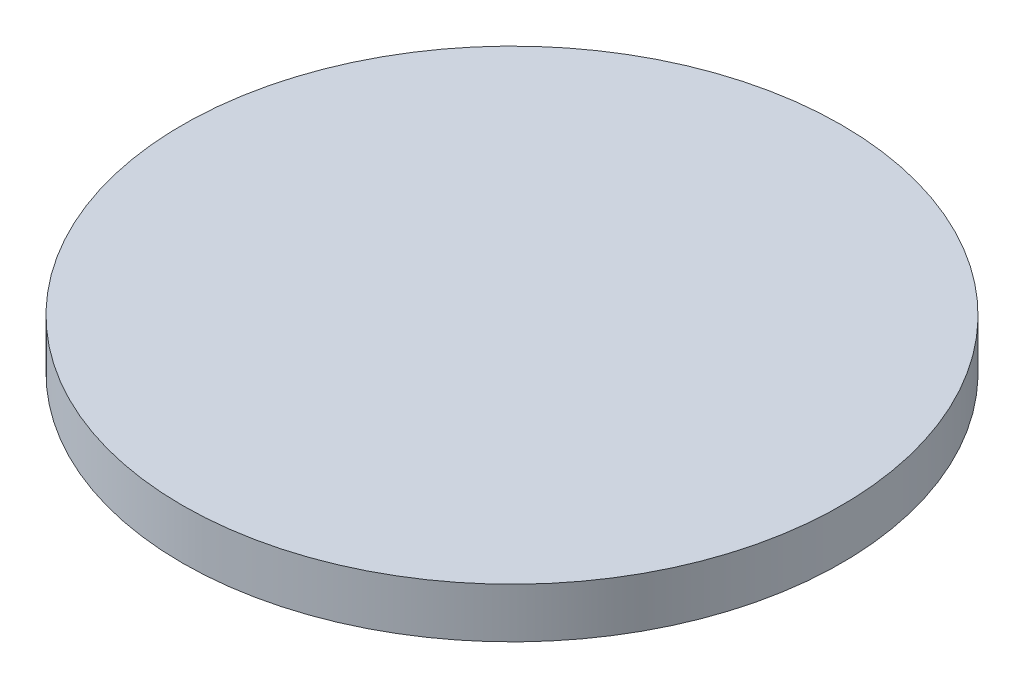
SolidWorks part; units mm, degrees
ref_plane "Front Plane" through (0, 0, 0) normal (0, 0, 1) x (1, 0, 0)
ref_plane "Top Plane" through (0, 0, 0) normal (0, 1, 0) x (1, 0, 0)
ref_plane "Right Plane" through (0, 0, 0) normal (1, 0, 0) x (0, 0, -1)
sketch "Sketch1" plane through (0, 0, 0) normal (0, 1, 0) x (1, 0, 0)
  circle A0 centre (0, 0) radius 20.955
  dimension "D1" = 41.91
extrude "Extrude1" add sketch "Sketch1" along normal blind 3.175
